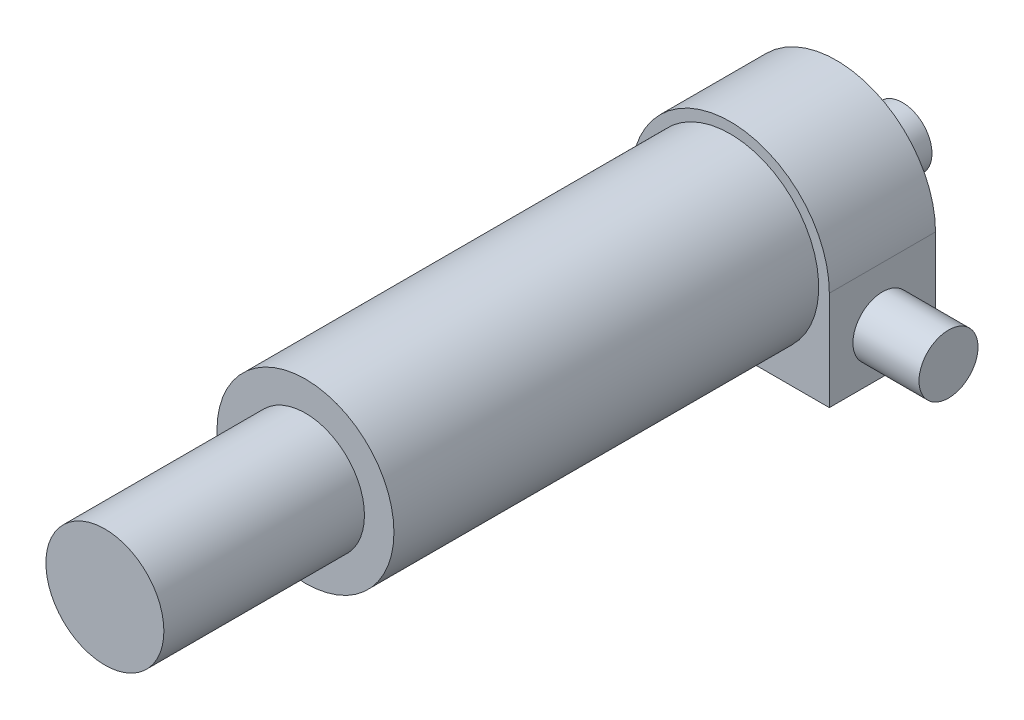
SolidWorks part; units mm, degrees
ref_plane "Plane1" through (0, 0, 0) normal (0, 0, 1) x (1, 0, 0)
ref_plane "Plane2" through (0, 0, 0) normal (0, 1, 0) x (1, 0, 0)
ref_plane "Plane3" through (0, 0, 0) normal (1, 0, 0) x (0, 0, -1)
sketch "Sketch1" plane through (0, 0, 0) normal (0, 0, 1) x (1, 0, 0)
  circle A0 centre (0, 0) radius 19.05
  dimension "D1" = 38.1
extrude "Ti_tube" add sketch "Sketch1" along normal blind 91.44
sketch "Sketch2" plane through (0, 0, 0) normal (0, 0, -1) x (-1, 0, 0)
  line L2 (-21.336, 0) -> (-21.336, -21.336)
  line L3 (-21.336, -21.336) -> (0, -21.336)
  arc A0 (0, -21.336) -> (0, 21.336) centre (0, 0) ccw
  arc A1 (0, 21.336) -> (-21.336, 0) centre (0, 0) ccw
  dimension "D1" = 42.672
  dimension "D2" = 30.1737
extrude "pump_housing" add sketch "Sketch2" along normal blind 22.86
sketch "Sketch3" plane through (21.336, 0, 0) normal (1, 0, 0) x (0, 0, -1)
  line L0 (11.43, -11.811) -> (11.43, -21.336) construction
  line L2 (22.86, -21.336) -> (0, -21.336) construction
  circle A0 centre (11.43, -11.811) radius 6.35
  dimension "D2" = 12.7
  dimension "D1" = 9.525
extrude "hose_barb1" add sketch "Sketch3" along normal blind 14.224
sketch "Sketch4" plane through (0, 0, -22.86) normal (0, 0, -1) x (-1, 0, 0)
  circle A0 centre (0, 0) radius 6.35
  dimension "D1" = 12.7
extrude "hose_barb2" add sketch "Sketch4" along normal blind 14.224
sketch "Sketch5" plane through (0, 0, 91.44) normal (0, 0, 1) x (1, 0, 0)
  circle A0 centre (0, 0) radius 12.7
  dimension "D1" = 25.4
extrude "uw_conn" add sketch "Sketch5" along normal blind 43.18
